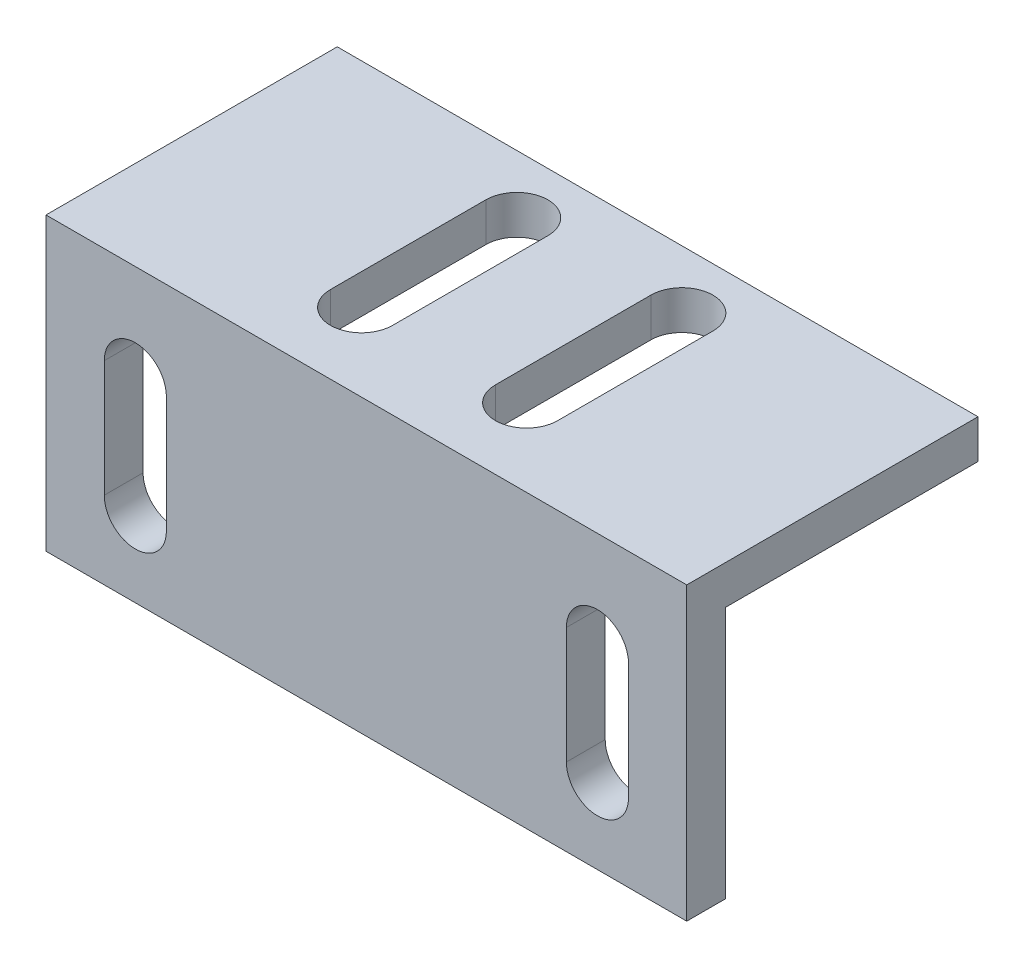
SolidWorks part; units mm, degrees
ref_plane "Спереди" through (0, 0, 0) normal (0, 0, 1) x (1, 0, 0)
ref_plane "Сверху" through (0, 0, 0) normal (0, 1, 0) x (1, 0, 0)
ref_plane "Справа" through (0, 0, 0) normal (1, 0, 0) x (0, 0, -1)
sketch "Эскиз1" plane through (0, 0, 0) normal (1, 0, 0) x (0, 0, -1)
  line L0 (0, 0) -> (0, 15)
  line L1 (0, 15) -> (15, 15)
  line L2 (15, 15) -> (15, 13)
  line L3 (15, 13) -> (2, 13)
  line L4 (2, 13) -> (2, 0)
  line L5 (2, 0) -> (0, 0)
  dimension "D1" = 2
  dimension "D2" = 15
  dimension "D3" = 2
  dimension "D4" = 15
  dimension "D5" = 13
extrude "Бобышка-Вытянуть1" add sketch "Эскиз1" along normal blind 33
sketch "Эскиз2" plane through (0, 0, 0) normal (0, 0, 1) x (1, 0, 0)
  line L0 (4.6, 10) -> (4.6, 4) construction
  line L1 (6.2, 10) -> (6.2, 4)
  line L2 (3, 10) -> (3, 4)
  line L3 (28.4, 10) -> (28.4, 4) construction
  line L4 (30, 10) -> (30, 4)
  line L5 (26.8, 10) -> (26.8, 4)
  line L6 (0, 15) -> (0, 0) construction
  line L7 (33, 15) -> (33, 0) construction
  line L8 (33, 15) -> (0, 15) construction
  arc A0 (6.2, 10) -> (3, 10) centre (4.6, 10) ccw
  arc A1 (3, 4) -> (6.2, 4) centre (4.6, 4) ccw
  arc A2 (30, 10) -> (26.8, 10) centre (28.4, 10) ccw
  arc A3 (26.8, 4) -> (30, 4) centre (28.4, 4) ccw
  point P2 (4.6, 7)
  point P7 (28.4, 7)
  dimension "D1" = 3.2
  dimension "D2" = 3.2
  dimension "D3" = 6
  dimension "D4" = 6
  dimension "D5" = 3
  dimension "D6" = 3
  dimension "D7" = 5
extrude "Вырез-Вытянуть1" cut sketch "Эскиз2" against normal through all
sketch "Эскиз3" plane through (0, 15, 0) normal (0, 1, 0) x (1, 0, 0)
  line L0 (12.25, 12) -> (12.25, 4) construction
  line L1 (13.85, 12) -> (13.85, 4)
  line L2 (10.65, 12) -> (10.65, 4)
  line L3 (20.75, 12) -> (20.75, 4) construction
  line L4 (22.35, 12) -> (22.35, 4)
  line L5 (19.15, 12) -> (19.15, 4)
  line L6 (33, 0) -> (0, 0) construction
  line L7 (33, 15) -> (0, 15) construction
  arc A0 (13.85, 12) -> (10.65, 12) centre (12.25, 12) ccw
  arc A1 (10.65, 4) -> (13.85, 4) centre (12.25, 4) ccw
  arc A2 (22.35, 12) -> (19.15, 12) centre (20.75, 12) ccw
  arc A3 (19.15, 4) -> (22.35, 4) centre (20.75, 4) ccw
  point P2 (12.25, 8)
  point P7 (20.75, 8)
  point P14 (16.5, 0)
extrude "Вырез-Вытянуть2" cut sketch "Эскиз3" against normal through all
equation "\"D6@Эскиз3\"=\"D5@Эскиз3\"/2"
